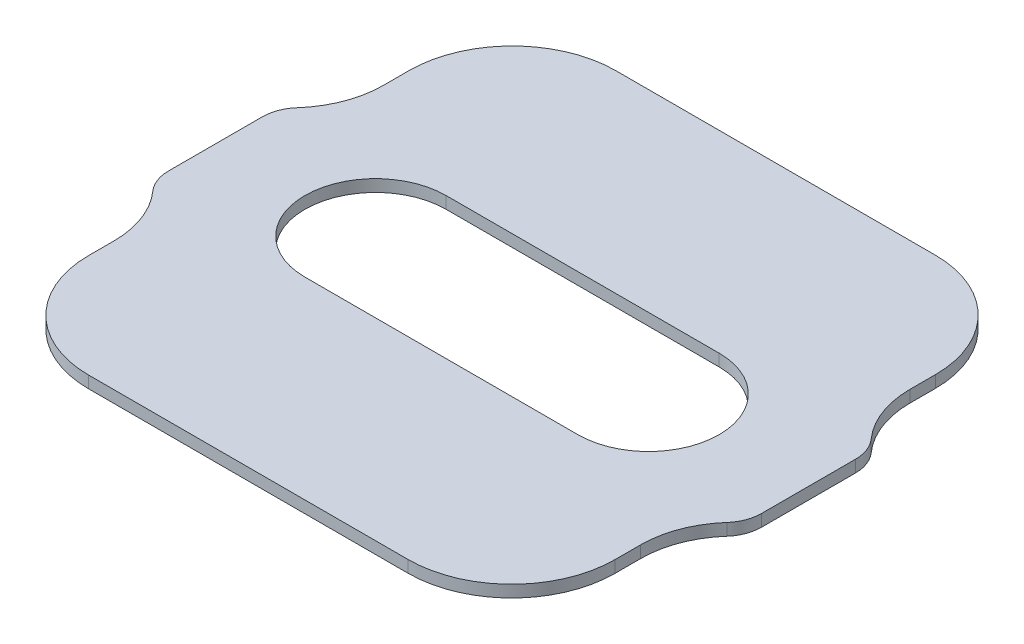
SolidWorks part; units mm, degrees
ref_plane "Front Plane" through (0, 0, 0) normal (0, 0, 1) x (1, 0, 0)
ref_plane "Top Plane" through (0, 0, 0) normal (0, 1, 0) x (1, 0, 0)
ref_plane "Right Plane" through (0, 0, 0) normal (1, 0, 0) x (0, 0, -1)
sketch "Sketch3" plane through (0, 0, 0) normal (0, 1, 0) x (1, 0, 0)
  line L0 (20.6415, -3.0308) -> (17.2491, -3.0308)
  line L1 (21.7415, -4.1305) -> (21.7415, -4.4007)
  line L2 (22.0953, -5.3308) -> (22.0953, -6.3308)
  line L3 (18.9453, -3.0308) -> (18.9453, -8.6308) construction
  line L4 (22.0953, -5.8308) -> (15.7953, -5.8308) construction
  line L5 (15.7953, -5.3308) -> (15.7953, -6.3308)
  line L6 (16.1491, -4.1305) -> (16.149, -4.4007)
  line L7 (21.7415, -7.531) -> (21.7415, -7.2608)
  line L8 (20.6415, -8.6308) -> (17.2491, -8.6308)
  line L9 (16.1491, -7.531) -> (16.149, -7.2608)
  arc A0 (20.6415, -3.0308) -> (21.7415, -4.1305) centre (20.6415, -4.1308) cw
  arc A1 (21.7415, -4.4007) -> (21.9942, -5.065) centre (22.7415, -4.4005) ccw
  arc A2 (21.9942, -5.065) -> (22.0953, -5.3308) centre (21.6953, -5.3308) cw
  arc A3 (15.8963, -5.065) -> (15.7953, -5.3308) centre (16.1953, -5.3308) ccw
  arc A4 (16.149, -4.4007) -> (15.8963, -5.065) centre (15.149, -4.4005) cw
  arc A5 (17.2491, -3.0308) -> (16.1491, -4.1305) centre (17.2491, -4.1308) ccw
  arc A6 (21.9942, -6.5965) -> (22.0953, -6.3308) centre (21.6953, -6.3308) ccw
  arc A7 (21.7415, -7.2608) -> (21.9942, -6.5965) centre (22.7415, -7.261) cw
  arc A8 (20.6415, -8.6308) -> (21.7415, -7.531) centre (20.6415, -7.5308) ccw
  arc A9 (17.2491, -8.6308) -> (16.1491, -7.531) centre (17.2491, -7.5308) cw
  arc A10 (16.149, -7.2608) -> (15.8963, -6.5965) centre (15.149, -7.261) ccw
  arc A11 (15.8963, -6.5965) -> (15.7953, -6.3308) centre (16.1953, -6.3308) cw
  dimension "D1" = 3.3924
extrude "Boss-Extrude3" add sketch "Sketch3" along normal blind 0.127
sketch "Sketch4" plane through (0, 0.127, 0) normal (0, 1, 0) x (1, 0, 0)
  line L0 (15.7953, -5.8308) -> (22.0953, -5.8308) construction
  line L1 (15.7953, -5.3308) -> (15.7953, -6.3308) construction
  line L2 (22.0953, -6.3308) -> (22.0953, -5.3308) construction
  line L3 (17.4953, -5.8308) -> (20.3953, -5.8308) construction
  line L4 (17.4953, -5.0808) -> (20.3953, -5.0808)
  line L5 (17.4953, -6.5808) -> (20.3953, -6.5808)
  arc A0 (17.4953, -5.0808) -> (17.4953, -6.5808) centre (17.4953, -5.8308) ccw
  arc A1 (20.3953, -6.5808) -> (20.3953, -5.0808) centre (20.3953, -5.8308) ccw
  point P8 (18.9453, -5.8308)
  dimension "D1" = 0.75
  dimension "D2" = 2.9
extrude "Cut-Extrude2" cut sketch "Sketch4" against normal through all
